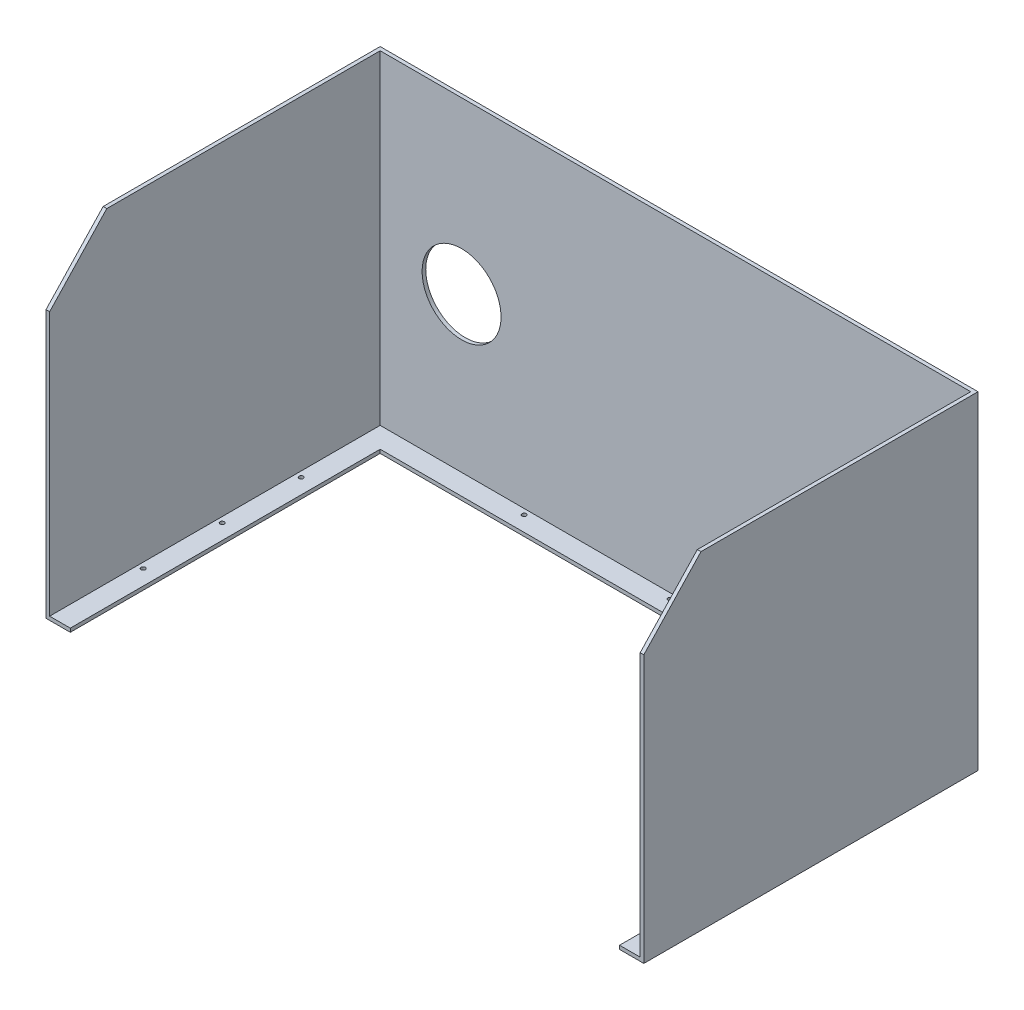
SolidWorks part; units mm, degrees
ref_plane "前视基准面" through (0, 0, 0) normal (0, 0, 1) x (1, 0, 0)
ref_plane "上视基准面" through (0, 0, 0) normal (0, 1, 0) x (1, 0, 0)
ref_plane "右视基准面" through (0, 0, 0) normal (1, 0, 0) x (0, 0, -1)
sketch "草图1" plane through (0, 0, 0) normal (0, 0, 1) x (1, 0, 0)
  line L0 (0, 0) -> (-176, 0) construction
  line L1 (246, 135) -> (-246, 135)
  line L2 (246, 135) -> (246, -135)
  line L3 (246, -135) -> (-246, -135)
  line L4 (-246, 135) -> (-246, -135)
  line L5 (246, 135) -> (-246, -135) construction
  line L6 (246, -135) -> (-246, 135) construction
  line L7 (0, 0) -> (176, 0) construction
  line L8 (176, 0) -> (176, -5) construction
  line L9 (-176, 0) -> (-176, -5) construction
  point P0 (0, 0)
  dimension "D1" = 492
  dimension "D2" = 270
extrude "凸台-拉伸2" add sketch "草图1" along normal blind 3
sketch "草图2" plane through (-246, 0, 0) normal (-1, 0, 0) x (0, 0, 1)
  line L0 (3, 135) -> (3, -135) construction
  line L1 (3, 135) -> (3, -135)
  line L2 (3, -135) -> (275, -135)
  line L3 (3, 135) -> (228, 135)
  line L4 (275, -135) -> (275, 85)
  line L5 (228, 135) -> (275, 85)
extrude "凸台-拉伸3" add sketch "草图2" against normal blind 3
sketch "草图3" plane through (246, 0, 0) normal (1, 0, 0) x (0, 0, -1)
  line L0 (-3, -135) -> (-3, 135) construction
  line L1 (-3, -135) -> (-3, 135)
  line L2 (-3, -135) -> (-275, -135) construction
  line L3 (-275, -135) -> (-275, 85) construction
  line L4 (-275, 85) -> (-228, 135) construction
  line L5 (-228, 135) -> (-3, 135) construction
  line L6 (-3, -135) -> (-275, -135)
  line L7 (-275, -135) -> (-275, 85)
  line L8 (-275, 85) -> (-228, 135)
  line L9 (-228, 135) -> (-3, 135)
extrude "凸台-拉伸4" add sketch "草图3" against normal blind 3
sketch "草图4" plane through (0, -135, 0) normal (0, -1, 0) x (1, 0, 0)
  line L0 (-243, 3) -> (-243, 275) construction
  line L1 (-243, 3) -> (243, 3) construction
  line L2 (243, 275) -> (243, 3) construction
  line L3 (-243, 3) -> (-243, 275)
  line L4 (-243, 3) -> (243, 3)
  line L5 (243, 275) -> (243, 3)
  line L6 (243, 275) -> (226, 275)
  line L7 (-243, 275) -> (-226, 275)
  line L8 (-226, 275) -> (-226, 20)
  line L9 (226, 275) -> (226, 20)
  line L10 (226, 20) -> (-226, 20)
extrude "凸台-拉伸5" add sketch "草图4" against normal blind 3
sketch "草图5" plane through (0, 0, 0) normal (0, 0, -1) x (-1, 0, 0)
  circle A0 centre (-176, -5) radius 20
  circle A1 centre (176, -5) radius 32.5
  dimension "D1" = 176
  dimension "D2" = 176
  dimension "D3" = 5
  dimension "D4" = 5
extrude "切除-拉伸1" cut sketch "草图5" against normal blind 3
sketch "草图6" plane through (0, -135, 0) normal (0, -1, 0) x (1, 0, 0)
  line L0 (246, 275) -> (246, 0) construction
  line L1 (-246, 275) -> (-246, 0) construction
  line L2 (-246, 0) -> (246, 0) construction
  circle A0 centre (-238.5, 202.5) radius 1.75
  circle A1 centre (-238.5, 137.5) radius 1.75
  circle A2 centre (-238.5, 72.5) radius 1.75
  circle A3 centre (-120, 7.5) radius 1.75
  circle A4 centre (0, 7.5) radius 1.75
  circle A5 centre (120, 7.5) radius 1.75
  circle A6 centre (238.5, 202.5) radius 1.75
  circle A7 centre (238.5, 137.5) radius 1.75
  circle A8 centre (238.5, 72.5) radius 1.75
  dimension "D1" = 7.5
  dimension "D2" = 7.5
  dimension "D3" = 7.5
  dimension "D4" = 7.5
  dimension "D5" = 7.5
  dimension "D6" = 7.5
  dimension "D7" = 7.5
  dimension "D8" = 7.5
  dimension "D9" = 7.5
  dimension "D10" = 126
  dimension "D11" = 120
  dimension "D12" = 120
  dimension "D13" = 72.5
  dimension "D14" = 72.5
  dimension "D15" = 65
  dimension "D16" = 65
  dimension "D17" = 65
  dimension "D18" = 65
extrude "切除-拉伸2" cut sketch "草图6" against normal blind 3
